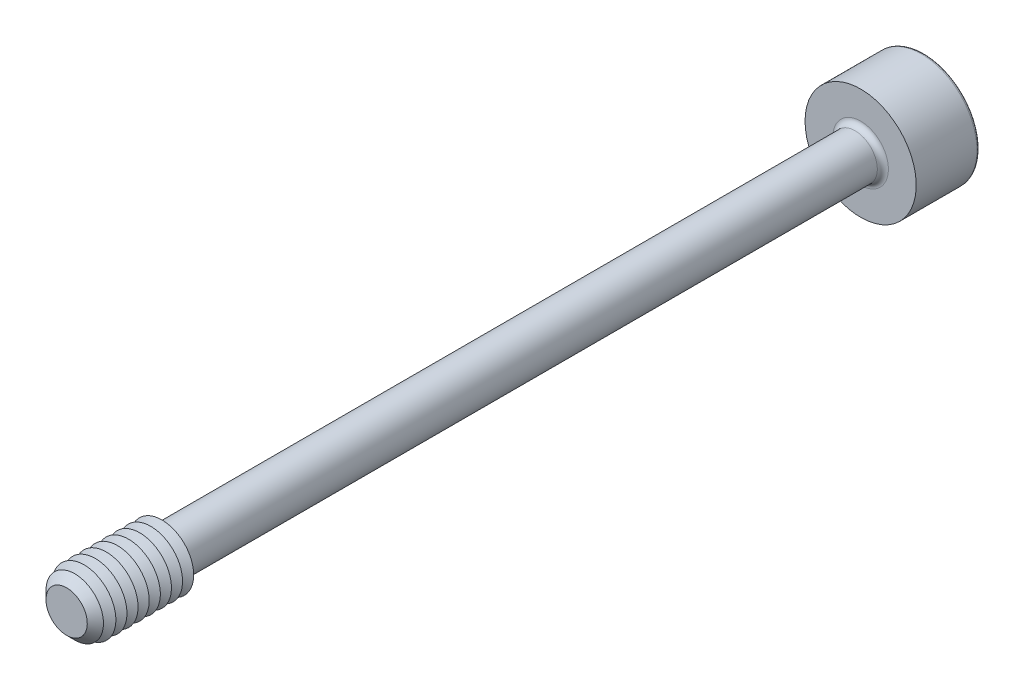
SolidWorks part; units mm, degrees
ref_plane "Front Plane" through (0, 0, 0) normal (0, 0, 1) x (1, 0, 0)
ref_plane "Top Plane" through (0, 0, 0) normal (0, 1, 0) x (1, 0, 0)
ref_plane "Right Plane" through (0, 0, 0) normal (1, 0, 0) x (0, 0, -1)
sketch "Sketch1" plane through (0, 0, 0) normal (0, 0, 1) x (1, 0, 0)
  circle A0 centre (0, 0) radius 1.4
  dimension "D1" = 2.8
extrude "Extrude1" add sketch "Sketch1" along normal mid plane 50
sketch "Sketch2" plane through (0, 0, 0) normal (1, 0, 0) x (0, 0, -1)
  line L0 (-25, 0) -> (-25, 2)
  line L1 (-25, 1.4) -> (-25, -1.4) construction
  line L2 (-25, 2) -> (-19, 2)
  line L3 (-19, 2) -> (-18.6536, 1.4)
  line L4 (25, 1.4) -> (-25, 1.4) construction
  line L5 (-18.6536, 1.4) -> (-18.6536, 0)
  line L6 (-18.6536, 0) -> (-25, 0)
  dimension "D1" = 2
  dimension "D2" = 120
  dimension "D3" = 6
revolve "Revolve1" add sketch "Sketch2" angle 360 about L6
chamfer "Chamfer1" distance 0.7 angle 45 1 edges at (0, 2, 25)
sketch "Sketch3" plane through (0, 0, -25) normal (0, 0, -1) x (-1, 0, 0)
  circle A0 centre (0, 0) radius 3.5
  dimension "D1" = 7
extrude "Extrude2" add sketch "Sketch3" along normal blind 4
sketch "Sketch4" plane through (-13.7, 0, -29) normal (0, 0, 1) x (1, 0, 0)
  line L2 (12.834, -1.5) -> (14.566, -1.5)
  line L3 (14.566, -1.5) -> (15.4321, 0)
  line L4 (15.4321, 0) -> (14.566, 1.5)
  line L6 (14.566, 1.5) -> (12.834, 1.5)
  line L7 (12.834, 1.5) -> (11.9679, 0)
  line L8 (11.9679, 0) -> (12.834, -1.5)
  circle A0 centre (13.7, 0) radius 1.5 construction
  dimension "D1" = 3
extrude "Extrude3" cut sketch "Sketch4" along normal blind 3
fillet "Fillet1" radius 0.35 1 edges at (-1.4, 0, -25)
fillet "Fillet2" radius 0.175 1 edges at (-3.5, 0, -29)
sketch "Sketch5" plane through (0, 0, 0) normal (1, 0, 0) x (0, 0, -1)
  line L0 (26, 0) -> (26, -1.5)
  line L1 (26, -1.5) -> (25.134, 0)
  line L2 (25.134, 0) -> (26, 0)
  dimension "D1" = 30
revolve "Cut-Revolve1" cut sketch "Sketch5" angle 360 about L2
sketch "Sketch6" plane through (0, 0, 0) normal (1, 0, 0) x (0, 0, -1)
  line L0 (1.332, 0) -> (-13.289, 0) construction
sketch "Sketch7" plane through (0, 0, 0) normal (1, 0, 0) x (0, 0, -1)
  line L0 (-19, 2) -> (-19.35, 1.3938)
  line L1 (-19.35, 1.3938) -> (-19.7, 2)
  line L2 (-19, 2) -> (-24.3, 2) construction
  line L3 (-19.7, 2) -> (-19, 2)
  dimension "D1" = 0.7
revolve "Cut-Revolve2" cut sketch "Sketch7" angle 360 about L0
pattern_linear "LPattern1" count 8 spacing 0.7 along (0, 0, 1) of "Cut-Revolve2"
